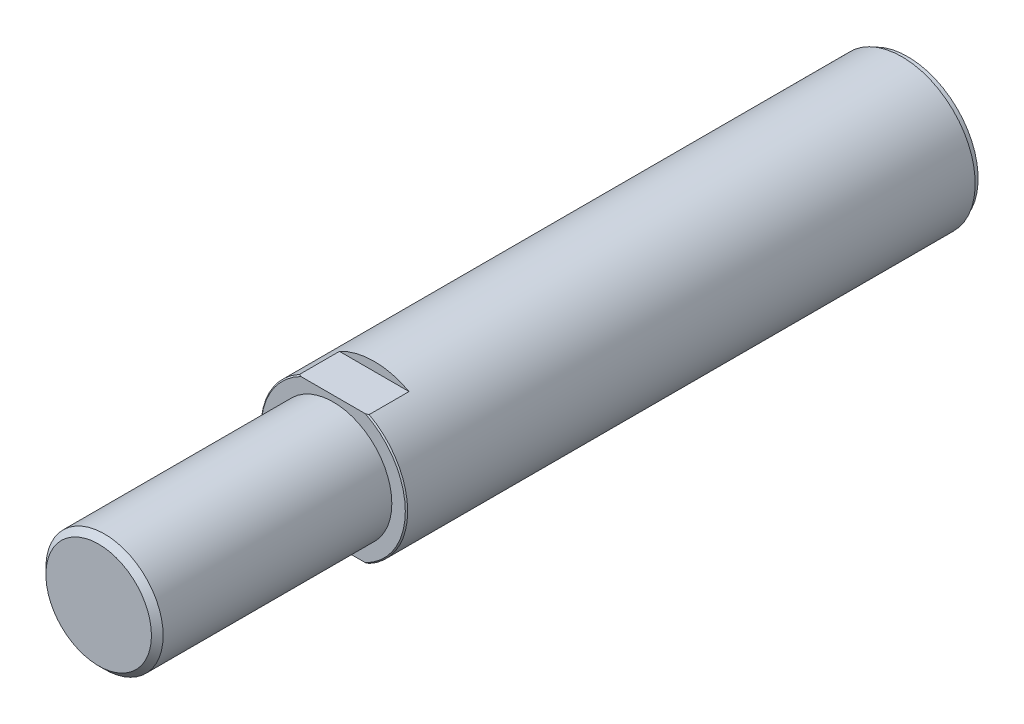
SolidWorks part; units mm, degrees
ref_plane "Plano frontal" through (0, 0, 0) normal (0, 0, 1) x (1, 0, 0)
ref_plane "Plano superior" through (0, 0, 0) normal (0, 1, 0) x (1, 0, 0)
ref_plane "Plano direito" through (0, 0, 0) normal (1, 0, 0) x (0, 0, -1)
sketch "Esboço1" plane through (0, 0, 0) normal (0, 0, 1) x (1, 0, 0)
  circle A0 centre (0, 0) radius 12.5
  dimension "D1" = 25
extrude "Ressalto-extrusão1" add sketch "Esboço1" along normal blind 138
sketch "Esboço2" plane through (0, 0, 138) normal (0, 0, 1) x (1, 0, 0)
  circle A0 centre (0, 0) radius 10
  dimension "D1" = 20
extrude "Corte-extrusão1" cut sketch "Esboço2" against normal blind 40 flip side to cut
hole_wizard "Furo roscado de M12x1.751" positions "Esboço3" profile "Esboço4" tap size "M12x1.75" standard "Ansi Metric"
sketch "Esboço3" plane through (0, 0, 0) normal (0, 0, -1) x (-1, 0, 0)
  point P0 (0, 0)
sketch "Esboço4" plane through (0, 0, 0) normal (1, 0, 0) x (0, 1, 0)
  line L0 (0, 0) -> (0, 35.8144)
  line L1 (0, 35.8144) -> (5.1, 32.75)
  line L2 (5.1, 32.75) -> (5.1, 0)
  line L5 (5.1, 0) -> (0, 0)
  line L10 (0, 35.8144) -> (-5.1, 32.75) construction
  line L11 (0, -6.35) -> (0, 107.95) construction
  dimension "Tap Drill Dia." = 10.2
  dimension "Tap Drill Depth" = 32.75
  dimension "Drill Angle" = 118
sketch "Esboço5" plane through (0, 0, 0) normal (0, 0, -1) x (-1, 0, 0)
  circle A0 centre (0, 0) radius 12
  dimension "D1" = 24
extrude "Corte-extrusão2" cut sketch "Esboço5" against normal blind 1 flip side to cut
chamfer "Chanfro1" distance 0.2 angle 45 1 edges at (12.5, 0, 98)
chamfer "Chanfro2" distance 1 angle 45 1 edges at (10, 0, 138)
sketch "Esboço6" plane through (0, 0, 98) normal (0, 0, 1) x (1, 0, 0)
  line L1 (-21.0914, -11) -> (21.0914, -11)
  line L2 (-21.0914, -11) -> (-21.0914, 11)
  line L3 (-21.0914, 11) -> (21.0914, 11)
  line L4 (21.0914, -11) -> (21.0914, 11)
  line L5 (-21.0914, -11) -> (21.0914, 11) construction
  line L6 (-21.0914, 11) -> (21.0914, -11) construction
  point P0 (0, 0)
  dimension "D1" = 22
extrude "Corte-extrusão3" cut sketch "Esboço6" against normal blind 7 flip side to cut
